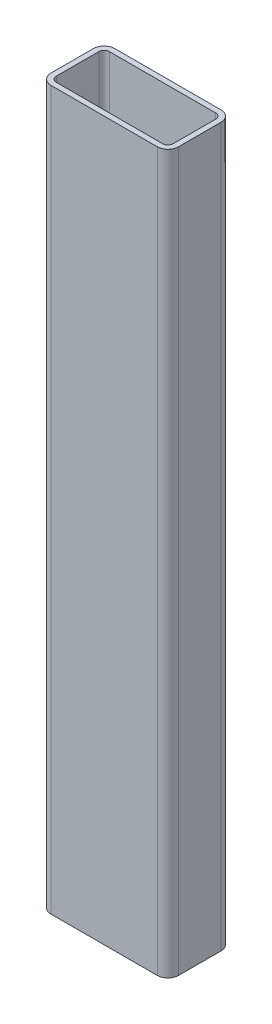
SolidWorks part; units mm, degrees
ref_plane "Front Plane" through (0, 0, 0) normal (0, 0, 1) x (1, 0, 0)
ref_plane "Top Plane" through (0, 0, 0) normal (0, 1, 0) x (1, 0, 0)
ref_plane "Right Plane" through (0, 0, 0) normal (1, 0, 0) x (0, 0, -1)
sketch "Sketch1" plane through (0, 0, 0) normal (0, 0, 1) x (1, 0, 0)
  line L0 (-1143.8617, -382.6216) -> (-1143.8617, -2097.1216)
  line L1 (-1443.8617, -2097.1216) -> (-443.8617, -2097.1216) construction
  line L2 (-1143.8617, -382.6216) -> (481.7383, -382.6216) construction
  dimension "D1" = 300
other "Structural Member1"
ref_plane "Plane2" through (-991.4617, -382.6216, -76.2) normal (0, -1, 0) x (0, 0, 1)
sketch "Sketch14" plane through (-991.4617, -382.6216, -76.2) normal (0, -1, 0) x (0, 0, 1)
  line L0 (-50.8, -139.7) -> (50.8, -139.7)
  line L1 (-63.5, -127) -> (-63.5, 127)
  line L2 (50.8, 139.7) -> (-50.8, 139.7)
  line L3 (63.5, 127) -> (63.5, -127)
  line L4 (-50.8, -152.4) -> (50.8, -152.4)
  line L5 (-76.2, -127) -> (-76.2, 127)
  line L6 (50.8, 152.4) -> (-50.8, 152.4)
  line L7 (76.2, 127) -> (76.2, -127)
  line L8 (0, 152.4) -> (0, 139.7) construction
  line L9 (0, 139.7) -> (0, -139.7) construction
  line L10 (0, -139.7) -> (0, -152.4) construction
  line L11 (-76.2, 0) -> (-63.5, 0) construction
  line L12 (-63.5, 0) -> (63.5, 0) construction
  line L13 (63.5, 0) -> (76.2, 0) construction
  arc A0 (76.2, 127) -> (50.8, 152.4) centre (50.8, 127) ccw
  arc A1 (50.8, -152.4) -> (76.2, -127) centre (50.8, -127) ccw
  arc A2 (-76.2, -127) -> (-50.8, -152.4) centre (-50.8, -127) ccw
  arc A3 (-50.8, 152.4) -> (-76.2, 127) centre (-50.8, 127) ccw
  arc A4 (-50.8, 139.7) -> (-63.5, 127) centre (-50.8, 127) ccw
  arc A5 (63.5, 127) -> (50.8, 139.7) centre (50.8, 127) ccw
  arc A6 (50.8, -139.7) -> (63.5, -127) centre (50.8, -127) ccw
  arc A7 (-63.5, -127) -> (-50.8, -139.7) centre (-50.8, -127) ccw
  point P6 (-76.2, 152.4)
  point P33 (76.2, 152.4)
  point P35 (-76.2, -152.4)
  point P36 (76.2, -152.4)
  point P37 (0, 0)
  dimension "D1" = 25.4
  dimension "Thickness" = 12.7
  dimension "V_leg" = 304.8
  dimension "H_leg" = 152.4
